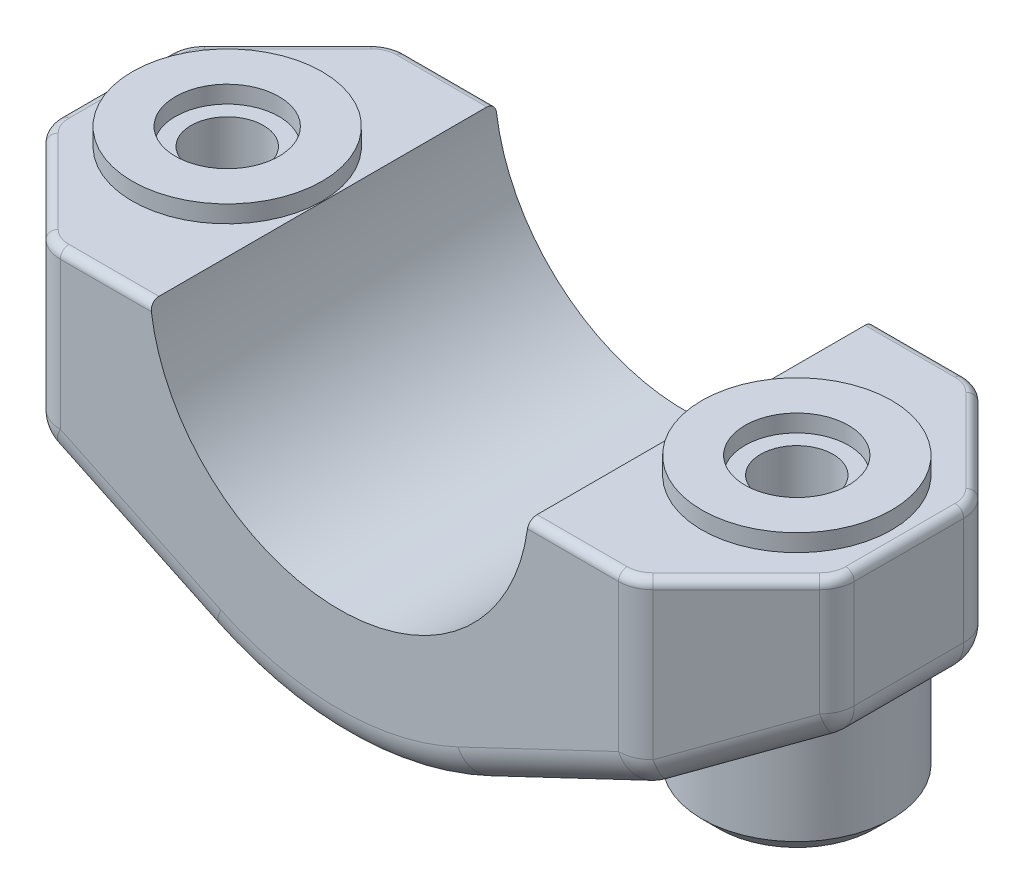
SolidWorks part; units mm, degrees
ref_plane "Plan de face" through (0, 0, 0) normal (0, 0, 1) x (1, 0, 0)
ref_plane "Plan de dessus" through (0, 0, 0) normal (0, 1, 0) x (1, 0, 0)
ref_plane "Plan de droite" through (0, 0, 0) normal (1, 0, 0) x (0, 0, -1)
sketch "Esquisse1" plane through (0, 0, 0) normal (0, 0, 1) x (1, 0, 0)
  line L0 (-10.9545, -1) -> (-23, -1)
  line L1 (-23, -1) -> (-23, -9)
  line L2 (-23, -9) -> (-7.7251, -16.258)
  line L3 (7.7251, -16.258) -> (23, -9)
  line L4 (23, -9) -> (23, -1)
  line L5 (23, -1) -> (10.9545, -1)
  line L6 (0, 8.5194) -> (0, -32.293) construction
  arc A0 (-10.9545, -1) -> (10.9545, -1) centre (0, 0) ccw
  arc A1 (-7.7251, -16.258) -> (7.7251, -16.258) centre (0, 0) ccw
  point P13 (0, -19.9287)
  dimension "D1" = 22
  dimension "D4" = 8
  dimension "D5" = 18
  dimension "D2" = 1
  dimension "D3" = 46
extrude "Boss.-Extru.1" add sketch "Esquisse1" along normal mid plane 20
chamfer "Chanfrein1" distance 6 angle 45 4 edges at (-23, -5, 10) (23, -5, 10) (23, -5, -10) (-23, -5, -10)
fillet "Congé1" radius 2 8 edges at (17, -6.4255, -10) (23, -5, -4) (23, -5, 4) (17, -6.4255, 10) (-17, -6.4255, 10) (-23, -5, 4) (-17, -6.4255, -10) (-23, -5, -4)
fillet "Congé2" radius 2 20 edges at (-16.9369, -11.8809, -9.8478) (-20, -10.4255, -7) (-22.8478, -9.0723, -3.9369) (-23, -9, 0) (-22.8478, -9.0723, 3.9369) (-20, -10.4255, 7) (-16.9369, -11.8809, 9.8478) (-11.9484, -14.2513, 10) (0, -18, 10) (11.9484, -14.2513, 10) (16.9369, -11.8809, 9.8478) (20, -10.4255, 7) (22.8478, -9.0723, 3.9369) (23, -9, 0) (22.8478, -9.0723, -3.9369) (20, -10.4255, -7) (16.9369, -11.8809, -9.8478) (11.9484, -14.2513, -10) (0, -18, -10) (-11.9484, -14.2513, -10)
sketch "Esquisse2" plane through (0, -1, 0) normal (0, 1, 0) x (1, 0, 0)
  line L0 (0, 12.5954) -> (0, -16.1754) construction
  circle A0 centre (-16.5, 0) radius 5.5
  circle A1 centre (16.5, 0) radius 5.5
  dimension "D1" = 11
  dimension "D2" = 33
extrude "Boss.-Extru.2" add sketch "Esquisse2" against normal blind 15.5
chamfer "Chanfrein2" distance 1 angle 45 2 edges at (-22, -16.5, 0) (11, -16.5, 0)
hole_wizard "Trou taraudé M51" positions "Esquisse4" profile "Esquisse3" tap size "M5" standard "ISO"
sketch "Esquisse4" plane through (0, -16.5, 0) normal (0, -1, 0) x (-1, 0, 0)
  point P0 (16.5, 0)
  point P3 (-16.5, 0)
sketch "Esquisse3" plane through (-16.5, -16.5, 0) normal (1, 0, 0) x (0, 0, -1)
  line L0 (0, 0) -> (0, 15.5)
  line L1 (0, 15.5) -> (2.1, 15.5)
  line L2 (2.1, 15.5) -> (2.1, 0)
  line L5 (2.1, 0) -> (0, 0)
  line L11 (0, -6.35) -> (0, 107.95) construction
  dimension "Diamètre du trou pour taraudage jusqu'au prochain" = 4.2
  dimension "Profondeur du trou pour taraudage jusqu'au prochain" = 15.5
fillet "Congé3" radius 0.5 18 edges at (13.563, -1, 10) (16.9369, -1, 9.8478) (20, -1, 7) (22.8478, -1, 3.9369) (23, -1, 0) (22.8478, -1, -3.9369) (20, -1, -7) (16.9369, -1, -9.8478) (-13.563, -1, -10) (-16.9369, -1, -9.8478) (-13.563, -1, 10) (-16.9369, -1, 9.8478) (-20, -1, 7) (-22.8478, -1, 3.9369) (-23, -1, 0) (-22.8478, -1, -3.9369) (13.563, -1, -10) (-20, -1, -7)
sketch "Esquisse5" plane through (0, -1, 0) normal (0, 1, 0) x (1, 0, 0)
  circle A0 centre (-16.5, 0) radius 5.5
  circle A1 centre (16.5, 0) radius 5.5
  circle A2 centre (-16.5, 0) radius 3
  circle A3 centre (16.5, 0) radius 3
  dimension "D1" = 11
  dimension "D2" = 6
extrude "Boss.-Extru.3" add sketch "Esquisse5" along normal blind 1
